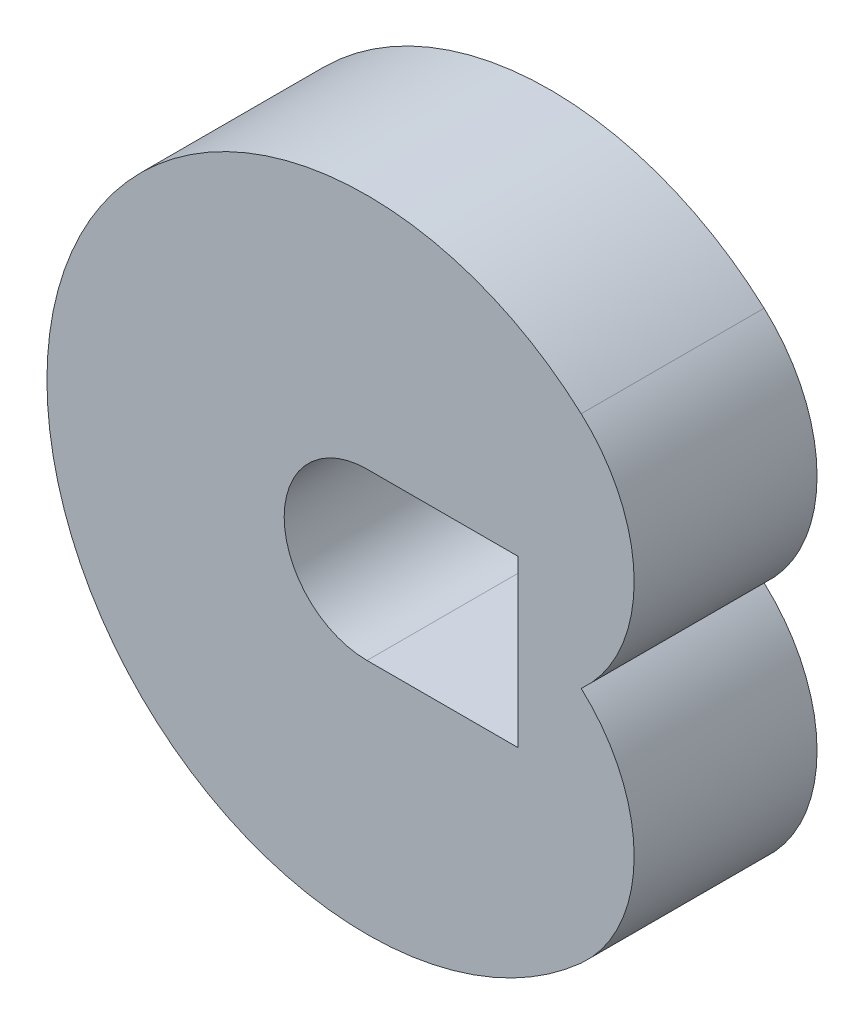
SolidWorks part; units mm, degrees
ref_plane "前视基准面" through (0, 0, 0) normal (0, 0, 1) x (1, 0, 0)
ref_plane "上视基准面" through (0, 0, 0) normal (0, 1, 0) x (1, 0, 0)
ref_plane "右视基准面" through (0, 0, 0) normal (1, 0, 0) x (0, 0, -1)
sketch "草图1" plane through (0, 0, 0) normal (0, 0, 1) x (1, 0, 0)
  line L0 (0, 0) -> (468.3914, 520.2014) construction
  line L1 (0, 0) -> (468.3914, -520.2014) construction
  line L2 (0, 0) -> (-791.161, 0) construction
  line L3 (0, 0) -> (-350, 0) construction
  line L4 (0, 181.1733) -> (330, 181.1733)
  line L5 (330, 181.1733) -> (330, -181.1733)
  line L6 (330, -181.1733) -> (0, -181.1733)
  arc A0 (468.3914, 520.2014) -> (468.3914, -520.2014) centre (0, 0) ccw
  arc A1 (468.3914, 520.2014) -> (468.3914, 0) centre (234.1957, 260.1007) cw
  arc A2 (468.3914, -520.2014) -> (468.3914, 0) centre (234.1957, -260.1007) ccw
  arc A3 (0, 181.1733) -> (0, -181.1733) centre (0, 0) ccw
  dimension "D1" = 700
  dimension "D2" = 350
  dimension "D3" = 132
  dimension "D4" = 330
  dimension "D5" = 350
extrude "凸台-拉伸1" add sketch "草图1" along normal blind 400 contours A0 A2 A1 | L4 L5 L6 A3
